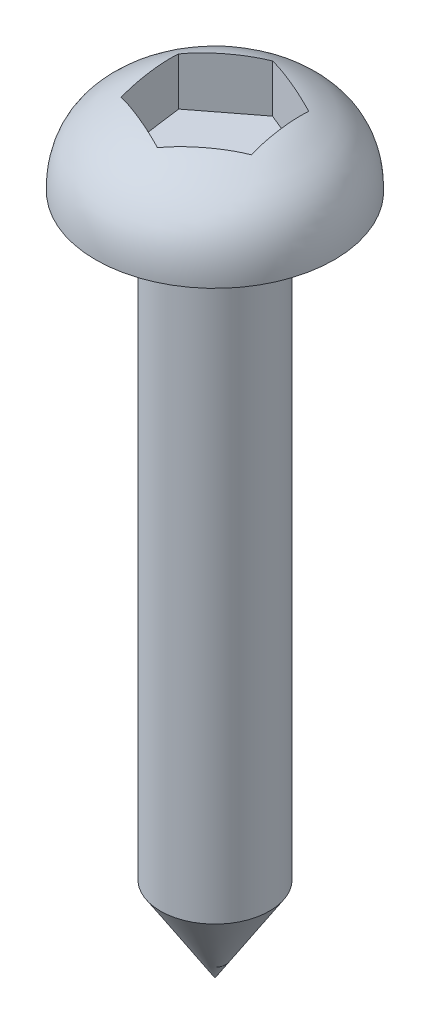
SolidWorks part; units mm, degrees
ref_plane "Plan de face" through (0, 0, 0) normal (0, 0, 1) x (1, 0, 0)
ref_plane "Plan de dessus" through (0, 0, 0) normal (0, 1, 0) x (1, 0, 0)
ref_plane "Plan de droite" through (0, 0, 0) normal (1, 0, 0) x (0, 0, -1)
ref_plane "Plan3" through (0, 6.4, 0) normal (0, 1, 0) x (-1, 0, 0)
sketch "Esquisse1" plane through (0, 6.4, 0) normal (0, 1, 0) x (-1, 0, 0)
  circle A0 centre (0, 0) radius 1.6
extrude "Extrusion1" add sketch "Esquisse1" against normal blind 20
sketch "Esquisse2" plane through (0, 0, 0) normal (0, 0, 1) x (1, 0, 0)
  line L0 (-4.2764, 6.4) -> (4.3058, 6.4) construction
  line L1 (0, 9.4343) -> (0, 4.7448) construction
  line L2 (-2.6992, 8.85) -> (4.0303, 8.85) construction
  line L3 (-3.5, 8.6386) -> (-3.5, 5.3938) construction
  line L4 (0, 6.4) -> (-3.5, 6.4)
  line L5 (0, 8.85) -> (0, 6.4)
  spline S0 degree 3 poles (-3.5, 6.4) (-3.5136, 7.6713) (-2.8318, 8.1334) (-1.6947, 8.7749) (-1.2367, 8.8354) (0, 8.85) knots 0 0 0 0 0.491355 0.491355 1 1 1 1
  point P18 (-2.8, 8)
  point P21 (0, 6.4)
  dimension "D1" = 2.45
  dimension "D2" = 3.5
revolve "Révolution1" add sketch "Esquisse2" angle 360 about L1
chamfer "Chanfrein1" distance 1.6 distance2 2.5 1 edges at (0, -13.6, 1.6)
ref_plane "Plan4" through (0, 7.2, 0) normal (0, 1, 0) x (-1, 0, 0)
sketch "Esquisse4" plane through (0, 7.2, 0) normal (0, 1, 0) x (-1, 0, 0)
  line L1 (-1.8143, 0.7495) -> (-1.5562, -1.1964)
  line L2 (-1.5562, -1.1964) -> (0.258, -1.946)
  line L3 (0.258, -1.946) -> (1.8143, -0.7495)
  line L4 (1.8143, -0.7495) -> (1.5562, 1.1964)
  line L5 (1.5562, 1.1964) -> (-0.258, 1.946)
  line L6 (-0.258, 1.946) -> (-1.8143, 0.7495)
  circle A0 centre (0, 0) radius 1.7 construction
extrude "Enlèv. mat.-Extru.1" cut sketch "Esquisse4" along normal blind 2
